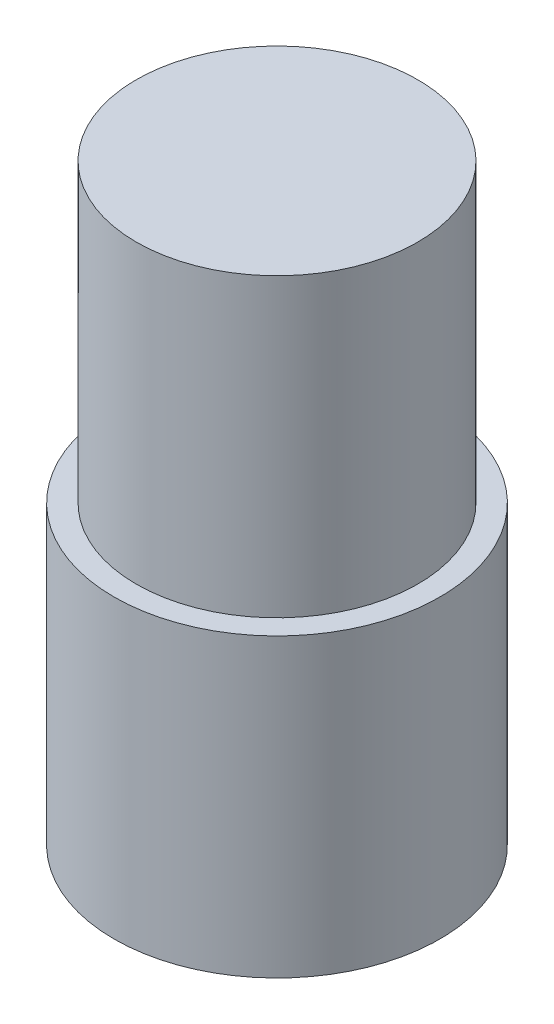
SolidWorks part; units mm, degrees
ref_plane "Front Plane" through (0, 0, 0) normal (0, 0, 1) x (1, 0, 0)
ref_plane "Top Plane" through (0, 0, 0) normal (0, 1, 0) x (1, 0, 0)
ref_plane "Right Plane" through (0, 0, 0) normal (1, 0, 0) x (0, 0, -1)
sketch "Sketch1" plane through (0, 0, 0) normal (0, 1, 0) x (1, 0, 0)
  circle A0 centre (0, 0) radius 1.2065
  dimension "D1" = 2.413
extrude "Boss-Extrude1" add sketch "Sketch1" along normal blind 5.08
sketch "Sketch2" plane through (0, 0, 0) normal (0, -1, 0) x (1, 0, 0)
  circle A0 centre (0, 0) radius 1.397
  dimension "D1" = 2.794
extrude "Boss-Extrude2" add sketch "Sketch2" against normal offset from surface (2.54 mm away) 2.54
